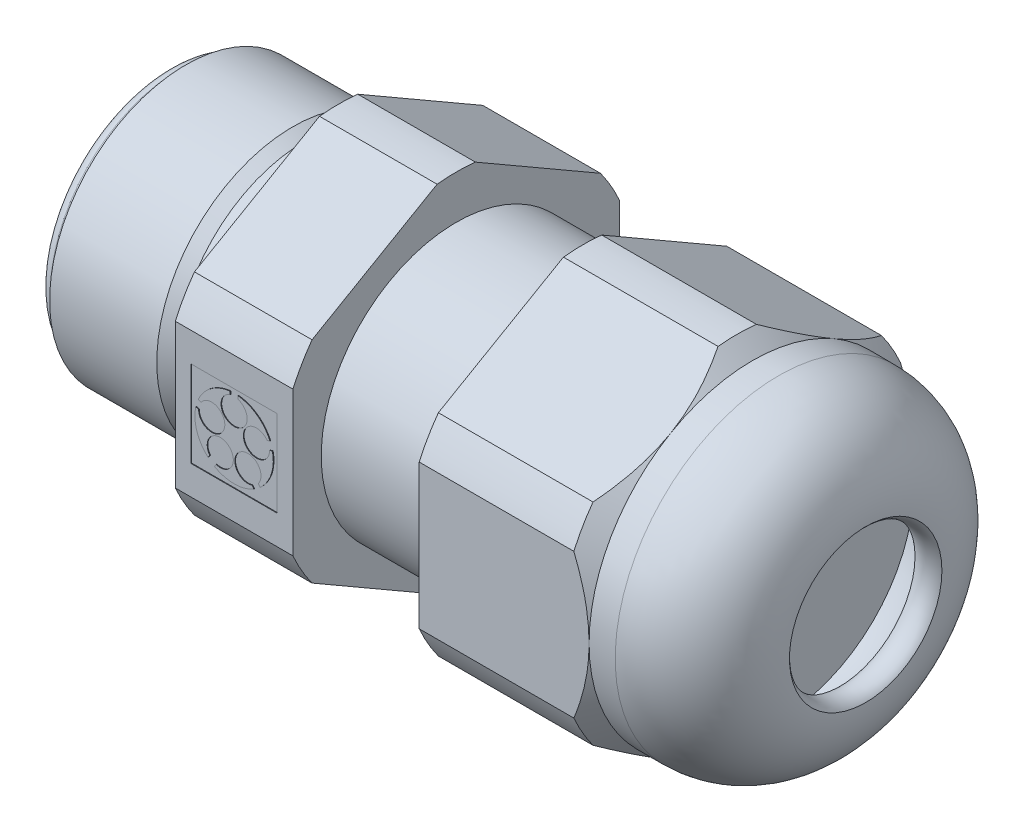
SolidWorks part; units mm, degrees
ref_plane "Face" through (0, 0, 0) normal (0, 0, 1) x (1, 0, 0)
ref_plane "Dessus" through (0, 0, 0) normal (0, 1, 0) x (1, 0, 0)
ref_plane "Droite" through (0, 0, 0) normal (1, 0, 0) x (0, 0, -1)
ref_plane "Plan1" through (0, 0, 0) normal (0, 0, 1) x (1, 0, 0)
sketch "Esquisse1" plane through (0, 0, 0) normal (0, 0, 1) x (1, 0, 0)
  line L0 (0, 5.4375) -> (0, 1.75)
  line L1 (0.5, 1.25) -> (28, 1.25)
  line L2 (28, 1.25) -> (28, 6.2)
  line L3 (28, 7.5) -> (26.8, 7.5)
  line L4 (26.8, 7.5) -> (24.3, 10)
  line L5 (24.3, 10) -> (19, 10)
  line L6 (19, 10) -> (19, 6.2)
  line L7 (19, 6.2) -> (13.2, 6.2)
  line L8 (13.2, 6.2) -> (13.2, 10)
  line L9 (13.2, 10) -> (7.8, 10)
  line L10 (7.8, 10) -> (7.8, 5.9375)
  line L11 (7.8, 5.9375) -> (6.24, 5.9375)
  line L12 (6.24, 5.9375) -> (5.6987, 6.25)
  line L13 (5.6987, 6.25) -> (0.78, 6.25)
  line L14 (0.78, 6.25) -> (0.78, 5.9375)
  line L15 (0.78, 5.9375) -> (0.5, 5.9375)
  line L16 (32, 0) -> (0, 0) construction
  arc A0 (0, 1.75) -> (0.5, 1.25) centre (0.5, 1.75) ccw
  arc A1 (28, 6.2) -> (30.6981, 3.6019) centre (28, 3.5) cw
  arc A2 (30.6981, 3.6019) -> (32, 3.5) centre (31.3851, 4.0118) ccw
  arc A3 (32, 3.5) -> (28, 7.5) centre (28, 3.5) ccw
  arc A4 (0.5, 5.9375) -> (0, 5.4375) centre (0.5, 5.4375) ccw
revolve "Révolution1" add sketch "Esquisse1" angle 360 about L16
ref_plane "Plan2" through (7.8, 0, 0) normal (1, 0, 0) x (0, 0, -1)
sketch "Esquisse2" plane through (7.8, 0, 0) normal (1, 0, 0) x (0, 0, -1)
  line L0 (-15, -15) -> (15, -15)
  line L1 (15, -15) -> (15, 15)
  line L2 (15, 15) -> (-15, 15)
  line L3 (-15, 15) -> (-15, -15)
  line L4 (-7.5, 3.3151) -> (-7.5, -3.3151)
  line L5 (-6.621, -4.8376) -> (-0.879, -8.1527)
  line L6 (0.879, -8.1527) -> (6.621, -4.8376)
  line L7 (7.5, -3.3151) -> (7.5, 3.3151)
  line L8 (6.621, 4.8376) -> (0.879, 8.1527)
  line L9 (-0.879, 8.1527) -> (-6.621, 4.8376)
  arc A0 (-7.5, -3.3151) -> (-6.621, -4.8376) centre (0, 0) ccw
  arc A1 (-0.879, -8.1527) -> (0.879, -8.1527) centre (0, 0) ccw
  arc A2 (6.621, -4.8376) -> (7.5, -3.3151) centre (0, 0) ccw
  arc A3 (7.5, 3.3151) -> (6.621, 4.8376) centre (0, 0) ccw
  arc A4 (0.879, 8.1527) -> (-0.879, 8.1527) centre (0, 0) ccw
  arc A5 (-6.621, 4.8376) -> (-7.5, 3.3151) centre (0, 0) ccw
extrude "Enlèv. mat.-Extru.1" cut sketch "Esquisse2" along normal blind 32
ref_plane "Plan3" through (0, 0, 7.5) normal (0, 0, 1) x (1, 0, 0)
sketch "Esquisse3" plane through (0, 0, 7.5) normal (0, 0, 1) x (1, 0, 0)
  line L0 (8.52, -1.98) -> (12.48, -1.98)
  line L1 (12.48, -1.98) -> (12.48, 1.98)
  line L2 (12.48, 1.98) -> (8.52, 1.98)
  line L3 (8.52, 1.98) -> (8.52, -1.98)
  line L4 (9.3017, -1.3431) -> (9.3831, -1.231)
  line L5 (9.6744, -1.4426) -> (9.5929, -1.5547)
  line L6 (11.4071, -1.5547) -> (11.3256, -1.4426)
  line L7 (11.6169, -1.231) -> (11.6983, -1.3431)
  line L8 (12.2589, 0.3823) -> (12.1271, 0.3394)
  line L9 (12.0159, 0.6818) -> (12.1477, 0.7246)
  line L10 (10.68, 1.791) -> (10.68, 1.6524)
  line L11 (10.32, 1.6524) -> (10.32, 1.791)
  line L12 (8.8523, 0.7246) -> (8.9841, 0.6818)
  line L13 (8.8729, 0.3394) -> (8.7411, 0.3823)
  arc A0 (8.7411, 0.3823) -> (9.3017, -1.3431) centre (10.5, 0) ccw
  arc A1 (9.3831, -1.231) -> (9.6744, -1.4426) centre (9.8652, -0.8737) cw
  arc A2 (9.5929, -1.5547) -> (11.4071, -1.5547) centre (10.5, 0) ccw
  arc A3 (11.3256, -1.4426) -> (11.6169, -1.231) centre (11.1348, -0.8737) cw
  arc A4 (11.6983, -1.3431) -> (12.2589, 0.3823) centre (10.5, 0) ccw
  arc A5 (12.1271, 0.3394) -> (12.0159, 0.6818) centre (11.5271, 0.3337) cw
  arc A6 (12.1477, 0.7246) -> (10.68, 1.791) centre (10.5, 0) ccw
  arc A7 (10.68, 1.6524) -> (10.32, 1.6524) centre (10.5, 1.08) cw
  arc A8 (10.32, 1.791) -> (8.8523, 0.7246) centre (10.5, 0) ccw
  arc A9 (8.9841, 0.6818) -> (8.8729, 0.3394) centre (9.4729, 0.3337) cw
extrude "Enlèv. mat.-Extru.2" cut sketch "Esquisse3" against normal blind 0.03
